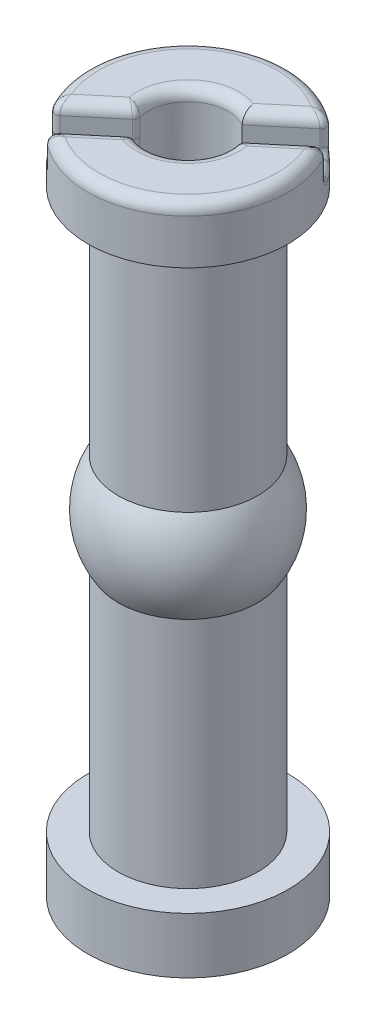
SolidWorks part; units mm, degrees
ref_plane "Plan de face" through (0, 0, 0) normal (0, 0, 1) x (1, 0, 0)
ref_plane "Plan de dessus" through (0, 0, 0) normal (0, 1, 0) x (1, 0, 0)
ref_plane "Plan de droite" through (0, 0, 0) normal (1, 0, 0) x (0, 0, -1)
imported_body "Importée1"
ref_plane "Plan1" through (-154.4493, 0, 0) normal (1, 0, 0) x (0, 1, 0)
sketch "Esquisse1" plane through (-154.4493, 0, 0) normal (1, 0, 0) x (0, 1, 0)
  line L0 (-50, 1192.317) -> (50, 1192.317) construction
  line L1 (15, 1192.317) -> (-15, 1192.317)
  line L2 (-50, 1192.317) -> (50, 1192.317) construction
  line L3 (-50, 1179.817) -> (-50, 1204.817) construction
  line L4 (50, 1204.817) -> (50, 1179.817) construction
  arc A0 (15, 1192.317) -> (-15, 1192.317) centre (0, 1192.317) ccw
  dimension "D1" = 15
revolve "Révolution1" add sketch "Esquisse1" angle 360 about L2
